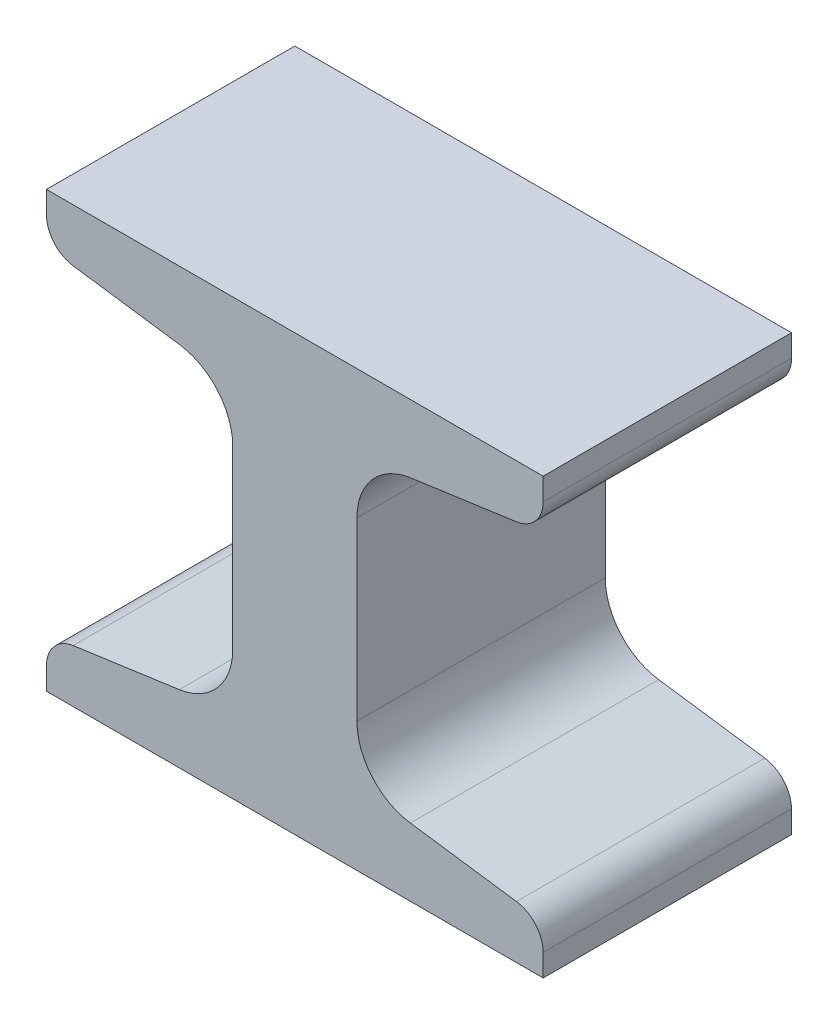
SolidWorks part; units mm, degrees
ref_plane "Plane1" through (0, 0, 0) normal (0, 0, 1) x (1, 0, 0)
ref_plane "Plane2" through (0, 0, 0) normal (0, 1, 0) x (-1, 0, 0)
ref_plane "Plane3" through (0, 0, 0) normal (1, 0, 0) x (0, 0, -1)
sketch "Sketch1" plane through (0, 0, 0) normal (0, 0, 1) x (1, 0, 0)
  line L0 (0, 0) -> (0, 5.0257)
  line L1 (0, 5.0257) -> (13.5837, 6.9348)
  line L2 (19.05, 13.223) -> (19.05, 31.227)
  line L3 (13.5837, 37.5152) -> (0, 39.4243)
  line L4 (0, 39.4243) -> (0, 44.45)
  line L5 (0, 44.45) -> (50.8, 44.45)
  line L6 (50.8, 44.45) -> (50.8, 39.4243)
  line L7 (50.8, 39.4243) -> (37.2163, 37.5152)
  line L8 (31.75, 31.227) -> (31.75, 13.223)
  line L9 (37.2163, 6.9348) -> (50.8, 5.0257)
  line L10 (50.8, 5.0257) -> (50.8, 0)
  line L11 (50.8, 0) -> (0, 0)
  line L12 (15.6984, 0) -> (-15.6984, 0) construction
  line L13 (0, -13.7361) -> (0, 13.7361) construction
  line L14 (50.8, 6.3644) -> (31.75, 6.3644) construction
  arc A0 (13.5837, 6.9348) -> (19.05, 13.223) centre (12.7, 13.223) ccw
  arc A1 (19.05, 31.227) -> (13.5837, 37.5152) centre (12.7, 31.227) ccw
  arc A2 (37.2163, 37.5152) -> (31.75, 31.227) centre (38.1, 31.227) ccw
  arc A3 (31.75, 13.223) -> (37.2163, 6.9348) centre (38.1, 13.223) ccw
  dimension "D7" = 8
  dimension "RI" = 6.35
  dimension "BF" = 50.8
  dimension "D6" = 8
  dimension "DEPTH" = 44.45
  dimension "TW" = 12.7
  dimension "D1" = 18.0041
  dimension "TF" = 6.3644
extrude "BaseSbeam" add sketch "Sketch1" along normal mid plane 25.4
fillet "ToeFillet" radius 3.175 4 edges at (50.8, 5.0257, 0) (0, 5.0257, 0) (50.8, 39.4243, 0) (0, 39.4243, 0)
equation "\"d1@Sketch1\" = \"Depth@Sketch1\" - 2*\"TF@Sketch1\" -  2*( \"RI@Sketch1\" * cos(\"D6@Sketch1\"/180*3.141592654))-2*((((\"BF@Sketch1\"-\"TW@Sketch1\")/4)-(\"RI@Sketch1\"-\"RI@Sketch1\"*sin(\"D6@Sketch1\"/180*3.141592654"
